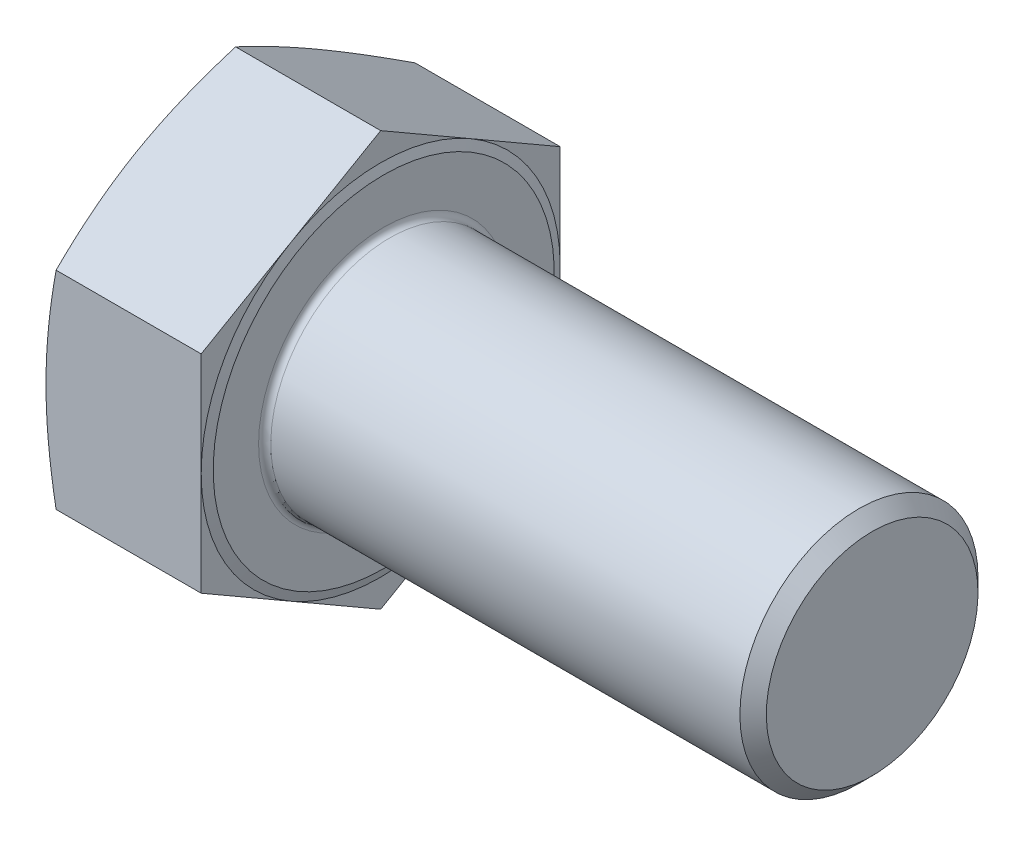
SolidWorks part; units mm, degrees
ref_plane "Front" through (0, 0, 0) normal (0, 0, 1) x (1, 0, 0)
ref_plane "Top" through (0, 0, 0) normal (0, 1, 0) x (1, 0, 0)
ref_plane "Right" through (0, 0, 0) normal (1, 0, 0) x (0, 0, -1)
sketch "Sketch-BaseHead" plane through (0, 0, 0) normal (1, 0, 0) x (0, 0, -1)
  line L1 (0, -33.9482) -> (29.4, -16.9741)
  line L2 (29.4, -16.9741) -> (29.4, 16.9741)
  line L3 (29.4, 16.9741) -> (0, 33.9482)
  line L4 (0, 33.9482) -> (-29.4, 16.9741)
  line L5 (-29.4, 16.9741) -> (-29.4, -16.9741)
  line L6 (-29.4, -16.9741) -> (0, -33.9482)
  circle A0 centre (0, 0) radius 29.4 construction
  dimension "s" = 58.8
extrude "BaseHead" add sketch "Sketch-BaseHead" along normal blind 25.42
sketch "Sketch4" plane through (-0.2646, -5.9169, 0) normal (0, 0, 1) x (0, 1, 0)
  line L0 (5.9169, 3.7369) -> (5.9169, -10.4477) construction
  line L2 (39.8651, -0.2646) -> (35.3169, -0.2646)
  line L4 (35.3169, -0.2646) -> (39.8651, -1.92)
  line L6 (39.8651, -1.92) -> (39.8651, -0.2646)
  dimension "D1" = 20
  dimension "D2" = 58.8
revolve "HeadChamfer" cut sketch "Sketch4" angle 360 about L0
sketch "Sketch1" plane through (0, 0, 0) normal (0, 1, 0) x (1, 0, 0)
  line L0 (25.42, 0) -> (25.92, 0)
  line L1 (25.92, 0) -> (25.92, 27.93)
  line L2 (25.92, 27.93) -> (25.42, 29.4)
  line L3 (25.42, 29.4) -> (25.42, 0)
  line L4 (-4.0016, 0) -> (10.1831, 0) construction
  dimension "D1" = 29.4
  dimension "D2" = 27.93
  dimension "D3" = 0.5
revolve "Revolve1" add sketch "Sketch1" angle 360 about axis through (-4.0016, 0, 0) along (1, 0, 0)
sketch "Sketch3" plane through (25.92, 0, 0) normal (1, 0, 0) x (0, 0, -1)
  circle A0 centre (0, 0) radius 19.5
  dimension "d" = 39
extrude "BaseBody" add sketch "Sketch3" along normal blind 80
chamfer "Chamfer1" distance 2.165 angle 45 1 edges at (105.92, 19.5, 0)
fillet "HeadFillet" radius 1 1 edges at (25.92, -19.5, 0)
equation "\"D1@Sketch1\" = \"s@Sketch-BaseHead\" / 2 "
equation "\"D2@Sketch4\" = \"s@Sketch-BaseHead\""
equation "\"D1@Chamfer1\" =  ( \"d@Sketch3\" - \"D2@ThreadCosmetic1\" ) / 2 "
